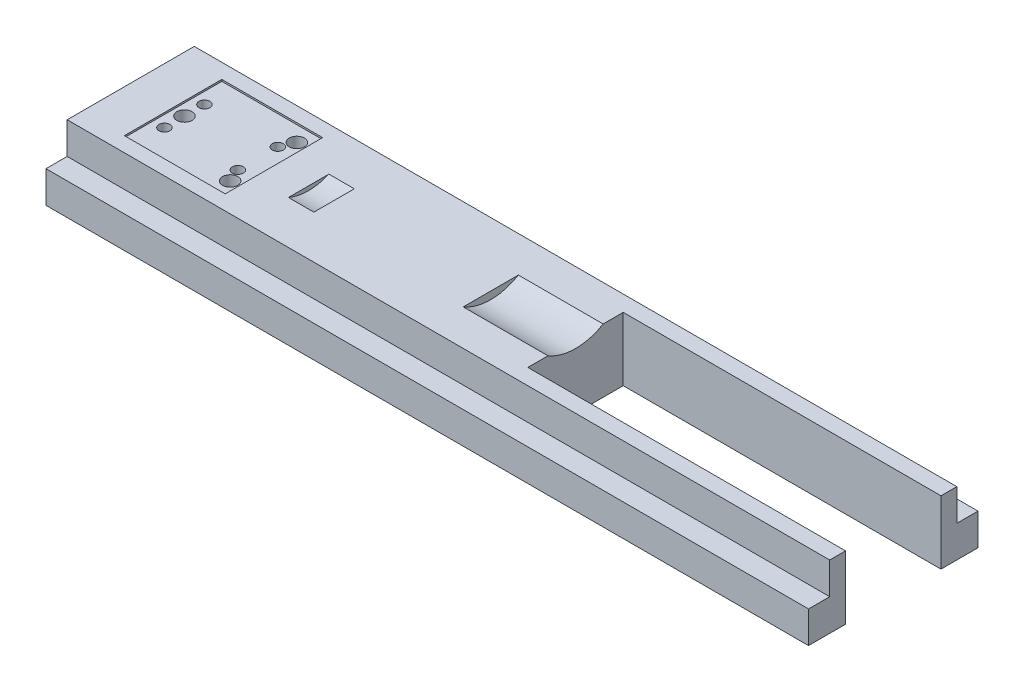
SolidWorks part; units mm, degrees
ref_plane "Front Plane" through (0, 0, 0) normal (0, 0, 1) x (1, 0, 0)
ref_plane "Top Plane" through (0, 0, 0) normal (0, 1, 0) x (1, 0, 0)
ref_plane "Right Plane" through (0, 0, 0) normal (1, 0, 0) x (0, 0, -1)
sketch "Sketch1" plane through (0, 0, 0) normal (0, 1, 0) x (1, 0, 0)
  line L1 (0, 0) -> (228.6, 0)
  line L2 (0, 0) -> (0, -50.8)
  line L3 (0, -50.8) -> (228.6, -50.8)
  line L4 (228.6, 0) -> (228.6, -50.8)
  dimension "D1" = 50.8
  dimension "D2" = 228.6
extrude "Boss-Extrude1" add sketch "Sketch1" against normal blind 19.05
sketch "Sketch2" plane through (0, 0, 0) normal (0, 1, 0) x (1, 0, 0)
  line L0 (0, 0) -> (0, -50.8) construction
  line L1 (12.7, -40.005) -> (42.926, -40.005)
  line L2 (12.7, -40.005) -> (12.7, -10.795)
  line L3 (12.7, -10.795) -> (42.926, -10.795)
  line L4 (42.926, -40.005) -> (42.926, -10.795)
  point P6 (0, -25.4)
  point P7 (12.7, -25.4)
  dimension "D1" = 29.21
  dimension "D2" = 30.226
  dimension "D3" = 12.7
extrude "Cut-Extrude1" cut sketch "Sketch2" against normal blind 0.508
sketch "Sketch3" plane through (0, -0.508, 0) normal (0, 1, 0) x (1, 0, 0)
  line L1 (0, 0) -> (0, -50.8) construction
  line L3 (12.7, -10.795) -> (12.7, -40.005) construction
  circle A0 centre (16.1036, -25.4) radius 2.286
  circle A1 centre (16.1036, -19.4056) radius 1.651
  circle A2 centre (16.1036, -31.3944) radius 1.651
  circle A3 centre (39.8018, -15.4051) radius 2.286
  circle A4 centre (39.8018, -35.3949) radius 2.286
  circle A5 centre (38.1, -19.4056) radius 1.651
  circle A6 centre (38.1, -31.3944) radius 1.651
  point P6 (0, -25.4)
  dimension "D1" = 4.572
  dimension "D5" = 3.302
  dimension "D6" = 3.302
  dimension "D8" = 4.572
  dimension "D9" = 4.572
  dimension "D14" = 3.302
  dimension "D16" = 3.302
  dimension "D2" = 3.4036
  dimension "D3" = 5.9944
  dimension "D4" = 5.9944
  dimension "D7" = 23.6982
  dimension "D10" = 23.6982
  dimension "D11" = 9.9949
  dimension "D12" = 9.9949
  dimension "D13" = 21.9964
  dimension "D15" = 21.9964
  dimension "D17" = 5.9944
extrude "Cut-Extrude2" cut sketch "Sketch3" against normal through all
sketch "Sketch5" plane through (228.6, 0, 0) normal (1, 0, 0) x (0, 0, -1)
  line L0 (-50.8, -19.05) -> (0, -19.05) construction
  line L1 (-40.005, -0.508) -> (-10.795, -0.508) construction
  circle A0 centre (-25.4, 13.9954) radius 16.256
  point P4 (-25.4, -19.05)
  dimension "D1" = 32.512
  dimension "D2" = 14.5034
extrude "Cut-Extrude3" cut sketch "Sketch5" against normal blind 101.6 from offset 19.05
sketch "Sketch6" plane through (228.6, 0, 0) normal (1, 0, 0) x (0, 0, -1)
  line L1 (-50.8, 0) -> (-44.45, 0)
  line L2 (-50.8, 0) -> (-50.8, -9.525)
  line L3 (-50.8, -9.525) -> (-44.45, -9.525)
  line L4 (-44.45, 0) -> (-44.45, -9.525)
  line L5 (0, 0) -> (-6.35, 0)
  line L6 (0, 0) -> (0, -9.525)
  line L7 (0, -9.525) -> (-6.35, -9.525)
  line L8 (-6.35, 0) -> (-6.35, -9.525)
  dimension "D1" = 6.35
  dimension "D2" = 9.525
  dimension "D3" = 9.525
  dimension "D4" = 6.35
extrude "Cut-Extrude4" cut sketch "Sketch6" against normal through all
sketch "Sketch7" plane through (228.6, 0, 0) normal (1, 0, 0) x (0, 0, -1)
  line L0 (-44.45, 0) -> (-6.35, 0) construction
  line L1 (-39.7002, 0) -> (-11.0998, 0)
  line L2 (-39.7002, 0) -> (-39.7002, -19.05)
  line L3 (-39.7002, -19.05) -> (-11.0998, -19.05)
  line L4 (-11.0998, 0) -> (-11.0998, -19.05)
  line L5 (-50.8, -19.05) -> (0, -19.05) construction
  line L6 (-44.45, -9.525) -> (-44.45, 0) construction
  line L7 (-6.35, 0) -> (-6.35, -9.525) construction
  dimension "D1" = 4.7498
  dimension "D2" = 4.7498
extrude "Cut-Extrude5" cut sketch "Sketch7" against normal blind 95.25
sketch "Sketch8" plane through (228.6, 0, 0) normal (1, 0, 0) x (0, 0, -1)
  circle A0 centre (-25.4, 13.9954) radius 15.2527
  dimension "D1" = 30.5054
extrude "Cut-Extrude6" cut sketch "Sketch8" against normal blind 7.62 from offset 167.64
sketch "Sketch9" plane through (0, -19.05, 0) normal (0, -1, 0) x (1, 0, 0)
  line L0 (0, 0) -> (0, 50.8) construction
  line L1 (7.9248, 7.9248) -> (47.625, 7.9248)
  line L2 (7.9248, 7.9248) -> (7.9248, 42.8752)
  line L3 (7.9248, 42.8752) -> (47.625, 42.8752)
  line L4 (47.625, 7.9248) -> (47.625, 42.8752)
  line L5 (0, 50.8) -> (228.6, 50.8) construction
  line L6 (228.6, 0) -> (0, 0) construction
  dimension "D1" = 7.9248
  dimension "D2" = 7.9248
  dimension "D3" = 7.9248
  dimension "D4" = 47.625
extrude "Cut-Extrude7" cut sketch "Sketch9" against normal blind 3.9624
